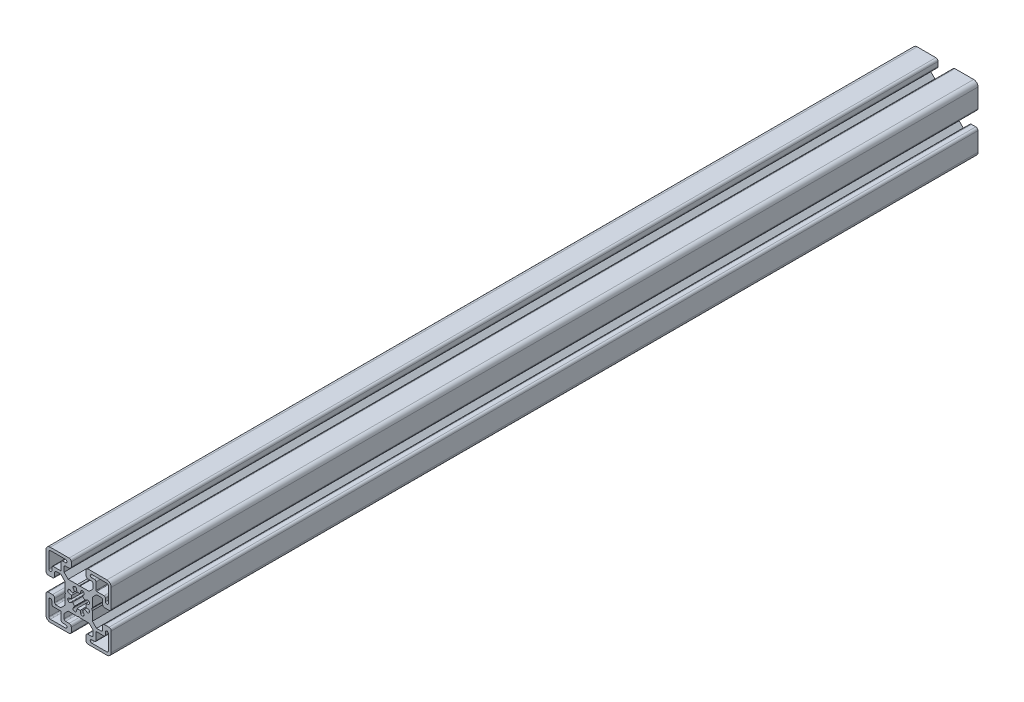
SolidWorks part; units mm, degrees
ref_plane "Front Plane" through (0, 0, 0) normal (0, 0, 1) x (1, 0, 0)
ref_plane "Top Plane" through (0, 0, 0) normal (0, 1, 0) x (1, 0, 0)
ref_plane "Right Plane" through (0, 0, 0) normal (1, 0, 0) x (0, 0, -1)
ref_plane "RIGHT" through (0, 0, 0) normal (1, 0, 0) x (0, 1, 0)
ref_plane "TOP" through (0, 0, 0) normal (0, 1, 0) x (0, 0, 1)
ref_plane "FRONT" through (0, 0, 0) normal (0, 0, 1) x (1, 0, 0)
imported_body "Imported1"
sketch "Sketch2" plane through (0, 0, -3048) normal (0, 0, -1) x (-1, 0, 0)
  line L1 (24.42, -24.4734) -> (-24.796, -24.4734)
  line L2 (24.42, -24.4734) -> (24.42, 24.7426)
  line L3 (24.42, 24.7426) -> (-24.796, 24.7426)
  line L4 (-24.796, -24.4734) -> (-24.796, 24.7426)
extrude "Cut-Extrude1" cut sketch "Sketch2" against normal up to surface (2450 mm away)
